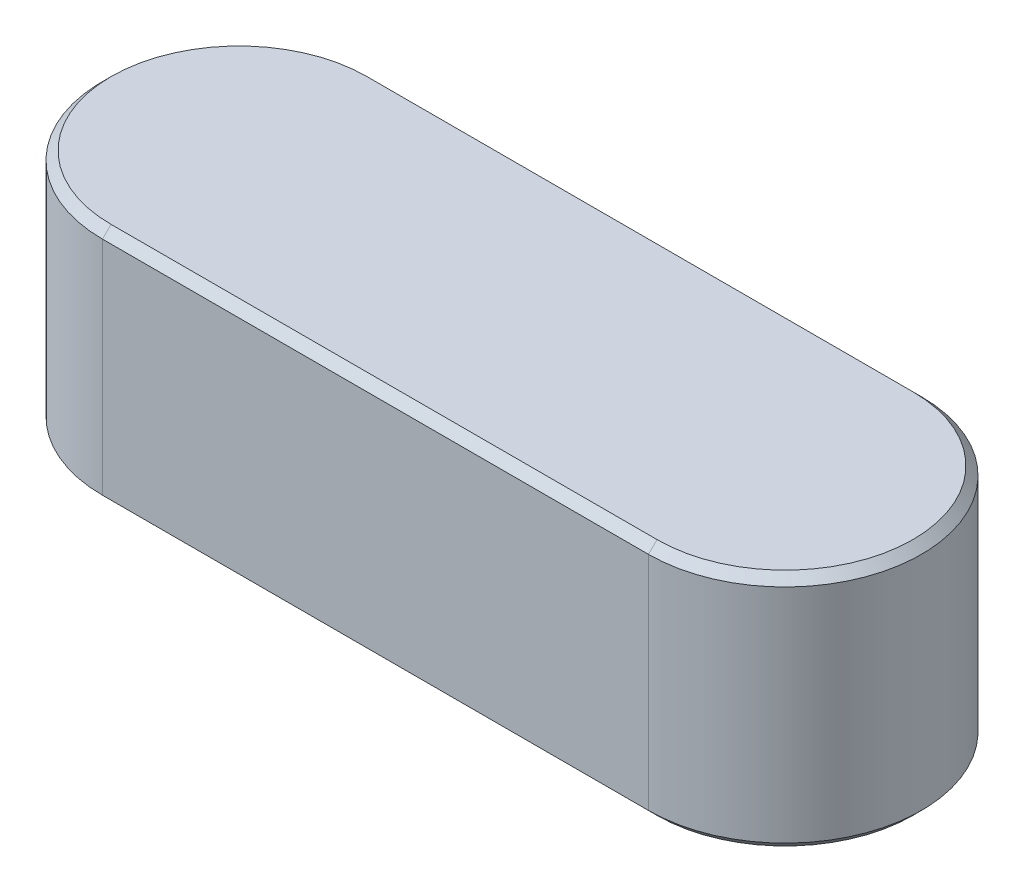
SolidWorks part; units mm, degrees
ref_plane "Plan1" through (0, 0, 0) normal (0, 0, 1) x (1, 0, 0)
ref_plane "Plan2" through (0, 0, 0) normal (0, 1, 0) x (1, 0, 0)
ref_plane "Plan3" through (0, 0, 0) normal (1, 0, 0) x (0, 0, -1)
sketch "Esquisse1" plane through (0, 0, 0) normal (0, 1, 0) x (1, 0, 0)
  line L0 (0, 0) -> (16, 0) construction
  line L1 (16, 4) -> (0, 4)
  line L2 (16, -4) -> (0, -4)
  line L3 (-4, -4) -> (-4, 4) construction
  line L4 (20, -4) -> (20, 4) construction
  arc A0 (0, 4) -> (0, -4) centre (0, 0) ccw
  arc A1 (16, 4) -> (16, -4) centre (16, 0) cw
  dimension "a" = 8
  dimension "l" = 24
extrude "Base-Extrusion" add sketch "Esquisse1" along normal blind 7
chamfer "Chanfrein1" distance 0.25 angle 45 8 edges at (20, 7, 0) (8, 7, -4) (-4, 7, 0) (8, 0, -4) (20, 0, 0) (8, 0, 4) (-4, 0, 0) (8, 7, 4)
ref_plane "Plan-tangent-arbre" through (0, 4, 0) normal (0, 1, 0) x (-1, 0, 0)
sketch "Section-rainure-alesage" plane through (0, 0, 0) normal (1, 0, 0) x (0, 0, -1)
  line L0 (4, 4) -> (4, 7.3) construction
  line L1 (50, 4) -> (-50, 4) construction
  line L2 (4, 7.3) -> (-4, 7.3) construction
  line L3 (-4, 7.3) -> (-4, 4) construction
  line L4 (-4, 4) -> (4, 4) construction
  line L5 (-4, 6.75) -> (-4, 0.25) construction
  line L6 (4, 6.75) -> (4, 0.25) construction
  dimension "k-d" = 3.3
